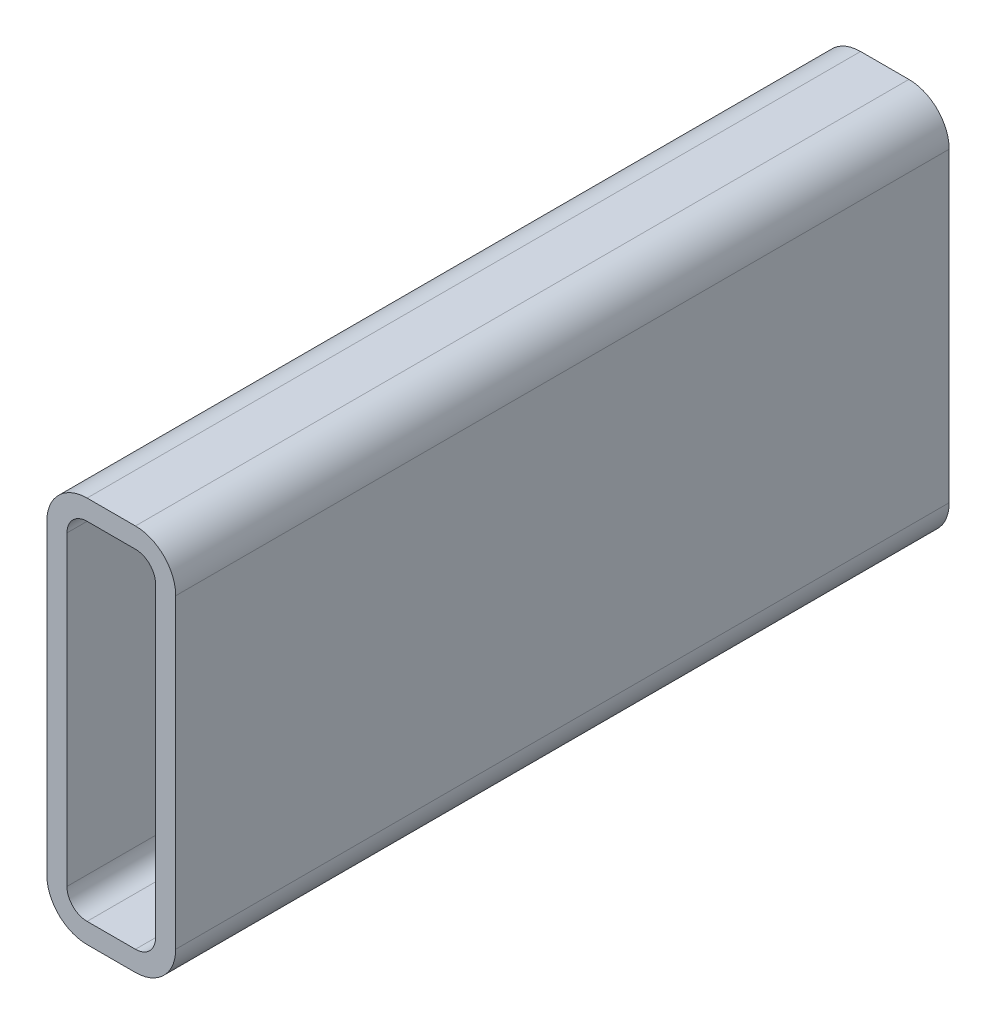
SolidWorks part; units mm, degrees
ref_plane "Front Plane" through (0, 0, 0) normal (0, 0, 1) x (1, 0, 0)
ref_plane "Top Plane" through (0, 0, 0) normal (0, 1, 0) x (1, 0, 0)
ref_plane "Right Plane" through (0, 0, 0) normal (1, 0, 0) x (0, 0, -1)
sketch "Sketch1" plane through (0, 0, 0) normal (0, 0, 1) x (1, 0, 0)
  line B0 (15.875, 152.4) -> (34.925, 152.4)
  arc B1 (50.8, 136.525) -> (34.925, 152.4) centre (34.925, 136.525) ccw
  line B2 (50.8, 136.525) -> (50.8, 15.875)
  arc B3 (34.925, 0) -> (50.8, 15.875) centre (34.925, 15.875) ccw
  line B4 (34.925, 0) -> (15.875, 0)
  arc B5 (0, 15.875) -> (15.875, 0) centre (15.875, 15.875) ccw
  line B6 (0, 15.875) -> (0, 136.525)
  arc B7 (15.875, 152.4) -> (0, 136.525) centre (15.875, 136.525) ccw
  line B8 (15.875, 144.4625) -> (34.925, 144.4625)
  arc B9 (42.8625, 136.525) -> (34.925, 144.4625) centre (34.925, 136.525) ccw
  line B10 (42.8625, 136.525) -> (42.8625, 15.875)
  arc B11 (34.925, 7.9375) -> (42.8625, 15.875) centre (34.925, 15.875) ccw
  line B12 (34.925, 7.9375) -> (15.875, 7.9375)
  arc B13 (7.9375, 15.875) -> (15.875, 7.9375) centre (15.875, 15.875) ccw
  line B14 (7.9375, 15.875) -> (7.9375, 136.525)
  arc B15 (15.875, 144.4625) -> (7.9375, 136.525) centre (15.875, 136.525) ccw
sketch_block_instance "HSS6x2x0.3125-1"
sketch_block "HSS6x2x0.3125"
extrude "Boss-Extrude1" add sketch "Sketch1" along normal blind 304.8
